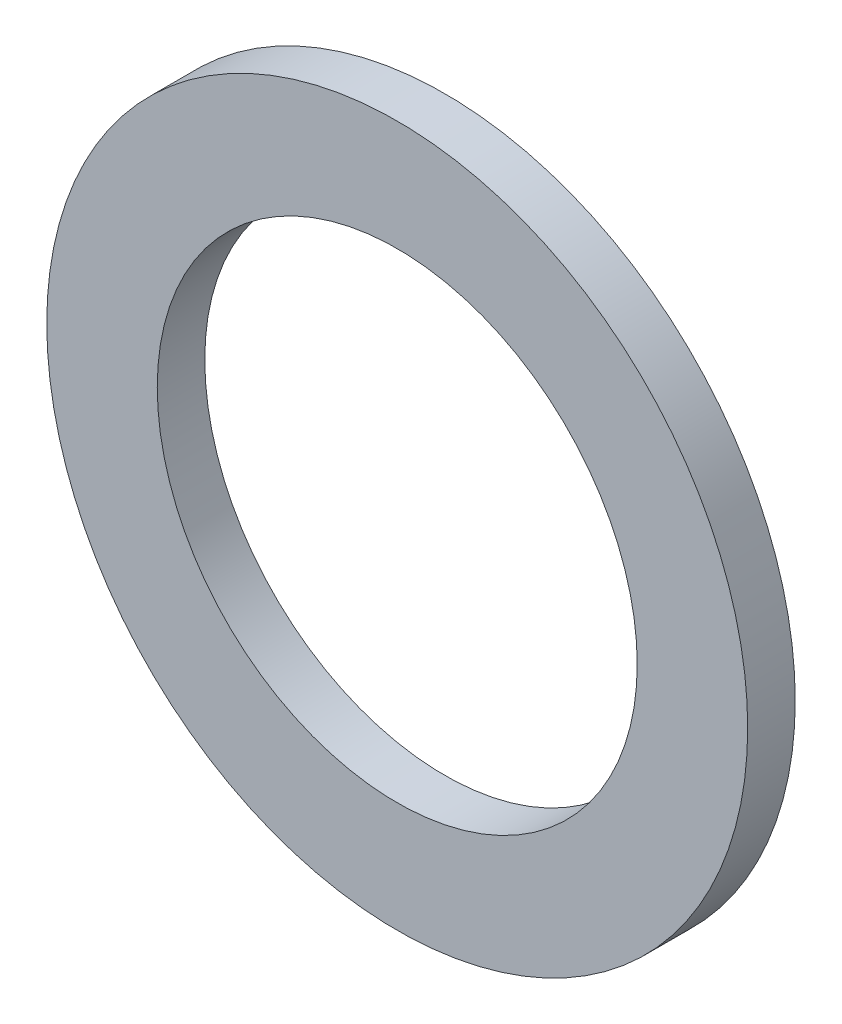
SolidWorks part; units mm, degrees
ref_plane "Plan1" through (0, 0, 0) normal (0, 0, 1) x (1, 0, 0)
ref_plane "Plan2" through (0, 0, 0) normal (0, 1, 0) x (1, 0, 0)
ref_plane "Plan3" through (0, 0, 0) normal (1, 0, 0) x (0, 0, -1)
sketch "Esquisse2" plane through (0, 0, 2.5) normal (0, 0, 1) x (1, 0, 0)
  circle A0 centre (16.875, 26.9784) radius 5.05
  circle A1 centre (16.875, 26.9784) radius 7.375
  dimension "D1" = 10.1
  dimension "D2" = 14.75
extrude "Base-Extrusion" add sketch "Esquisse2" along normal blind 1
